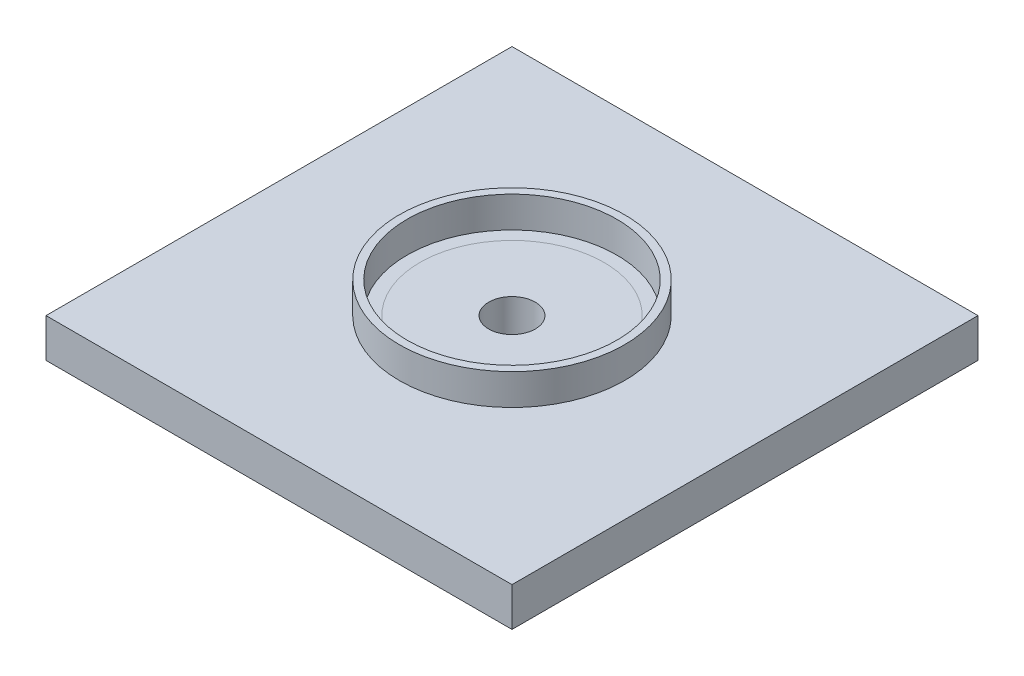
SolidWorks part; units mm, degrees
ref_plane "Front Plane" through (0, 0, 0) normal (0, 0, 1) x (1, 0, 0)
ref_plane "Top Plane" through (0, 0, 0) normal (0, 1, 0) x (1, 0, 0)
ref_plane "Right Plane" through (0, 0, 0) normal (1, 0, 0) x (0, 0, -1)
sketch "Sketch1" plane through (0, 0, 0) normal (0, 1, 0) x (1, 0, 0)
  line L0 (76.2, 76.2) -> (-76.2, -76.2) construction
  line L1 (-76.2, 76.2) -> (76.2, 76.2)
  line L2 (-76.2, 76.2) -> (-76.2, -76.2)
  line L3 (-76.2, -76.2) -> (76.2, -76.2)
  line L4 (76.2, 76.2) -> (76.2, -76.2)
  circle A0 centre (0, 0) radius 7.62
  dimension "D2" = 15.24
  dimension "D1" = 152.4
extrude "Extrude1" add sketch "Sketch1" along normal blind 12.7
sketch "Sketch2" plane through (0, 12.7, 0) normal (0, 1, 0) x (1, 0, 0)
  circle A3 centre (0, 0) radius 34.29
  circle A4 centre (0, 0) radius 36.83
  circle A5 centre (0, 0) radius 36.83
  dimension "D1" = 6.35
  dimension "D2" = 2.54
extrude "Extrude2" add sketch "Sketch2" along normal blind 10.16
sketch "Sketch3" plane through (0, 12.7, 0) normal (0, 1, 0) x (1, 0, 0)
  circle A0 centre (0, 0) radius 30.1138
